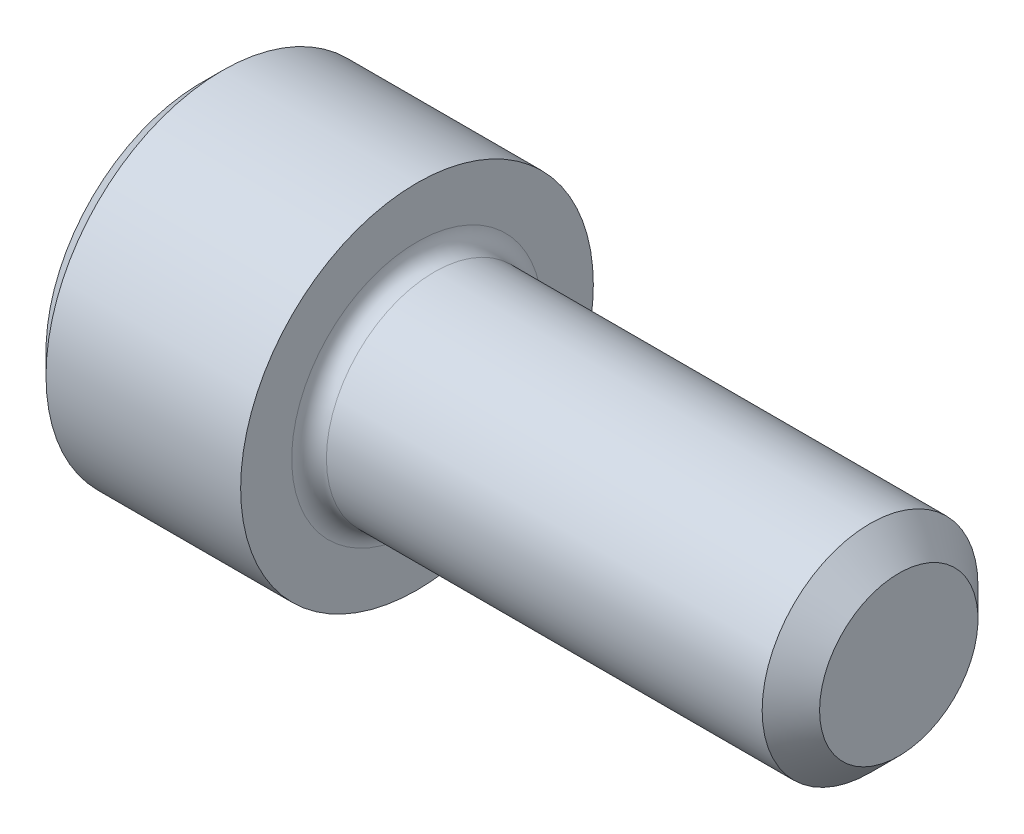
SolidWorks part; units mm, degrees
revolve "Base-Revolve" add sketch "BodySke"
sketch "BodySke" plane through (0, 0, 0) normal (0, 0, 1) x (1, 0, 0)
  line L0 (0, 0) -> (0, 2.0447)
  line L1 (0.2794, 2.3241) -> (2.8448, 2.3241)
  line L2 (2.8448, 2.3241) -> (2.8448, 1.4224)
  line L3 (2.8448, 1.4224) -> (8.8163, 1.4224)
  line L4 (9.1948, 1.0439) -> (9.1948, 0)
  line L5 (9.1948, 0) -> (0, 0)
  line L6 (-31.75, 0) -> (127, 0) construction
  line L7 (0, 2.0447) -> (0.2794, 2.3241)
  line L8 (9.1948, 1.0439) -> (8.8163, 1.4224)
  line L9 (0, -2.0447) -> (0.2794, -2.3241) construction
  line L10 (9.1948, -1.0439) -> (8.8163, -1.4224) construction
  line L11 (3.4798, 9.525) -> (3.4798, 3.175) construction
  line L12 (2.8448, 9.525) -> (2.8448, 3.175) construction
  line L13 (-28.9052, 9.525) -> (-28.9052, 3.175) construction
  dimension "Diameter" = 2.8448
  dimension "Head_ht" = 2.8448
  dimension "Length" = 6.35
  dimension "Body_ch_ang" = 45
  dimension "Head_dia" = 4.6482
  dimension "Head_ch_ang" = 45
  dimension "Head_side_ht" = 2.5654
  dimension "Minor_dia" = 2.0879
  dimension "Advance" = 0.635
  dimension "Thread_nom" = 6.35
  dimension "Thread_length" = 38.1
fillet "Fillet1" radius 0.2286 1 edges at (2.8448, 0, 1.4224)
ref_plane "Plane1" through (0, 0, 0) normal (0, 0, 1) x (1, 0, 0)
ref_plane "Plane2" through (0, 0, 0) normal (0, 1, 0) x (1, 0, 0)
ref_plane "Plane3" through (0, 0, 0) normal (1, 0, 0) x (0, 0, -1)
sketch "Sketch2" plane through (0, 0, 0) normal (0, 0, 1) x (1, 0, 0)
  line L0 (0, 1.1938) -> (1.2954, 1.1938)
  line L1 (1.2954, 1.1938) -> (1.9846, 0)
  line L2 (-31.75, 0) -> (127, 0) construction
  line L3 (1.9846, 0) -> (0, 0)
  line L4 (0, 0) -> (0, 1.1938)
  line L5 (0, 2.0447) -> (0, -2.0447) construction
  line L6 (0, 0) -> (47.625, 0) construction
  line L7 (2.8448, -2.3241) -> (2.8448, 2.3241) construction
revolve "Hex-PreBroach" cut sketch "Sketch2" angle 360 about L6
sketch "Sketch3" plane through (0, 0, 0) normal (-1, 0, 0) x (0, 0.5, 0.866)
  line L0 (0.6892, 1.1938) -> (-0.6892, 1.1938)
  line L1 (-0.6892, 1.1938) -> (-1.3785, 0)
  line L2 (0.6892, 1.1938) -> (1.3785, 0)
  line L3 (0.6892, -1.1938) -> (1.3785, 0)
  line L4 (0.6892, -1.1938) -> (-0.6892, -1.1938)
  line L5 (-0.6892, -1.1938) -> (-1.3785, 0)
extrude "Hex" cut sketch "Sketch3" against normal blind 1.2954
sketch "Sketch4" plane through (0, 0, 0) normal (-1, 0, 0) x (0, 0, 1)
  line L0 (0, 0) -> (1.4605, 0)
  line L1 (0, 0) -> (6.1484, 3.5498) construction
  line L2 (0, 0) -> (0.7302, 1.2648)
  line L3 (1.2009, 0.3267) -> (1.3933, 0.4378)
  line L4 (0.8834, 0.8767) -> (1.0758, 0.9877)
  arc A0 (1.2009, 0.3267) -> (0.8834, 0.8767) centre (0, 0) ccw
  arc A1 (1.4605, 0) -> (1.3933, 0.4378) centre (0, 0) ccw
  arc A2 (0.7302, 1.2648) -> (1.0758, 0.9877) centre (0, 0) cw
extrude "Spline" [suppressed] cut sketch "Sketch4" against normal blind 1.2954
pattern_circular "CirPattern1" [suppressed] count 6 every 60
sketch "Sketch5" plane through (0, 0, 0) normal (0, 0, 1) x (1, 0, 0)
  line L0 (-31.75, 0) -> (127, 0) construction
  line L2 (0, 2.0447) -> (0, -2.0447) construction
  circle A0 centre (1.016, 0) radius 0.4445
  dimension "Drilled_hole_dia" = 0.889
  dimension "Drilled_hole_loc" = 1.016
extrude "Hole" [suppressed] cut sketch "Sketch5" against normal through all and the other way through all
pattern_circular "Drilled-4" [suppressed] count 2 every 60
pattern_circular "Drilled-6" [suppressed] count 3 every 60
sketch "ThdSchSke" plane through (0, 0, 0) normal (0, 0, 1) x (1, 0, 0)
  line L0 (3.4798, -1.0439) -> (3.2148, -1.4224)
  line L1 (3.4798, -1.0439) -> (3.7448, -1.4224)
  line L2 (3.7448, -1.4224) -> (3.7448, -1.778)
  line L3 (-3.175, 0) -> (5.1513, 0) construction
  line L5 (3.7448, -1.778) -> (3.2148, -1.778)
  line L6 (3.2148, -1.778) -> (3.2148, -1.4224)
  line L7 (0, 2.0447) -> (0, -2.0447) construction
revolve "ThreadSchematic" [suppressed] cut sketch "ThdSchSke" angle 360 about L3
pattern_linear "ThdSchPat" [suppressed]
equation "\"D2@Sketch3\" = \"Hex_size@Sketch3\" / 2"
equation "\"D1@Sketch3\" = \"Hex_size@Sketch3\" / 2"
equation "\"D1@Sketch2\" = \"Hex_size@Sketch3\" / 2"
equation "\"D3@Sketch4\" = \"Spline_p_dim@Sketch4\" / 2"
equation "\"Thread_minor@ThreadCosmetic\"  =  \"Minor_dia@BodySke\""
equation "\"D2@CirPattern1\" = 360 / \"Num_teeth@CirPattern1\""
equation "\"Wall_thickness@Sketch2\" = \"Head_ht@BodySke\" - \"Key_eng@Hex\""
equation "\"Thread_length@ThreadCosmetic\" = ((sgn( (\"Length@BodySke\" - \"Advance@BodySke\" ) - \"Thread_nom@BodySke\" )-1)*( (\"Length@BodySke\" - \"Advance@BodySke\" ) - \"Thread_nom@BodySke\" ))/-2+ \"Thread_nom@BodySke\""
equation "\"Thread_minor@ThdSchSke\" = \"Minor_dia@BodySke\""
equation "\"Diameter@ThdSchSke\" = \"Diameter@BodySke\""
equation "\"Overcut@ThdSchSke\" = \"Diameter@BodySke\" * 1.25"
equation "\"Start@ThdSchSke\" = \"Head_ht@BodySke\" + \"Length@BodySke\" - \"Thread_length@ThreadCosmetic\"  '---Non-countersunk---"
equation "\"Num_threads@ThdSchPat\" = int( \"Thread_length@ThreadCosmetic\" / \"Advance@BodySke\" + 0.999 )  + 1"
equation "\"Advance@ThdSchPat\" = \"Thread_length@ThreadCosmetic\" /  (\"Num_threads@ThdSchPat\" - 1) 'relax it"
equation "\"Num_threads@ThdSchPat\" = \"Num_threads@ThdSchPat\" - sgn( \"Num_threads@ThdSchPat\" - 1) '---chamfered tips only---"
